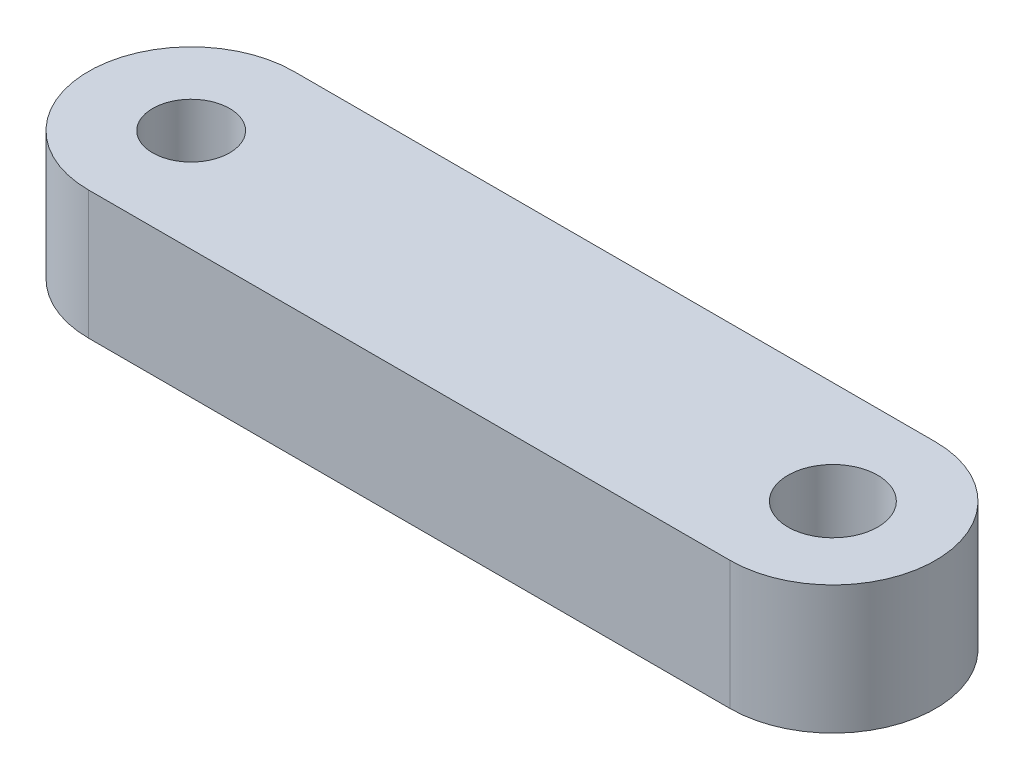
SolidWorks part; units mm, degrees
ref_plane "Alzado" through (0, 0, 0) normal (0, 0, 1) x (1, 0, 0)
ref_plane "Planta" through (0, 0, 0) normal (0, 1, 0) x (1, 0, 0)
ref_plane "Vista lateral" through (0, 0, 0) normal (1, 0, 0) x (0, 0, -1)
sketch "Croquis1" plane through (0, 0, 0) normal (0, 1, 0) x (1, 0, 0)
  line L0 (0, 0) -> (50, 0) construction
  line L1 (0, 8) -> (50, 8)
  line L2 (0, -8) -> (50, -8)
  arc A0 (0, 8) -> (0, -8) centre (0, 0) ccw
  arc A1 (50, -8) -> (50, 8) centre (50, 0) ccw
  circle A2 centre (50, 0) radius 3.5
  circle A3 centre (0, 0) radius 3
  point P3 (25, 0)
  dimension "D1" = 8
  dimension "D2" = 50
  dimension "D3" = 7
  dimension "D4" = 6
extrude "Saliente-Extruir1" add sketch "Croquis1" along normal blind 10
